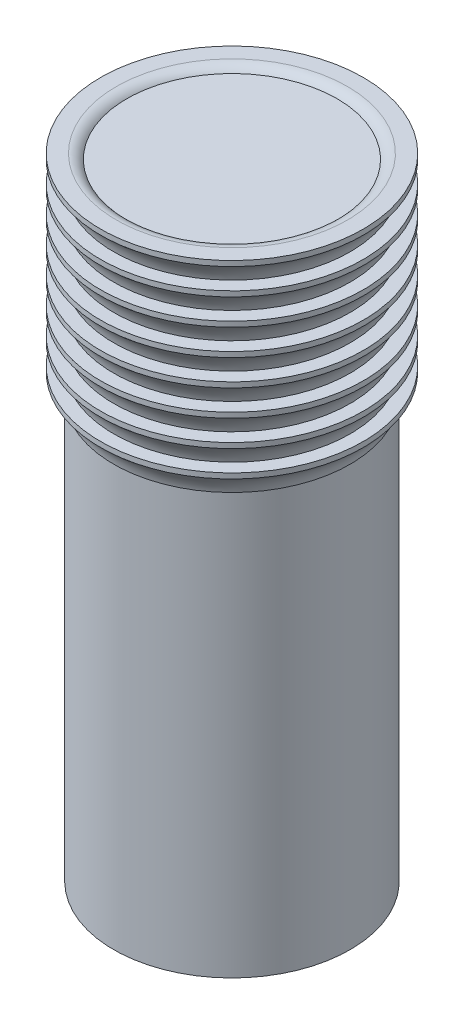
SolidWorks part; units mm, degrees
ref_plane "Alzado" through (0, 0, 0) normal (0, 0, 1) x (1, 0, 0)
ref_plane "Planta" through (0, 0, 0) normal (0, 1, 0) x (1, 0, 0)
ref_plane "Vista lateral" through (0, 0, 0) normal (1, 0, 0) x (0, 0, -1)
sketch "Croquis1" plane through (0, 0, 0) normal (0, 0, 1) x (1, 0, 0)
  line L0 (0, 0) -> (-25, 0)
  line L1 (-25, 0) -> (-25, -1)
  line L2 (-22.5, -5) -> (0, -5)
  line L3 (0, -5) -> (0, 0)
  line L5 (-25, 0) -> (-30.9208, 0)
  line L6 (-25, 0) -> (-25, -1)
  line L7 (-22.5, -5) -> (-30.1091, -5)
  arc A0 (-22.5, -5) -> (-25, -1) centre (-29.0964, -6.3415) ccw
  dimension "D4" = 22.5
  dimension "D1" = 25
  dimension "D2" = 5
  dimension "D3" = 1
revolve "Revolución2" add sketch "Croquis1" angle 360 about L3
pattern_linear "MatrizL1" count 8 spacing 5 along (0, 1, 0) of "Revolución2"
sketch "Croquis3" plane through (0, -5, 0) normal (0, -1, 0) x (1, 0, 0)
  circle A0 centre (0, 0) radius 22.5
  dimension "D1" = 45
extrude "Saliente-Extruir2" add sketch "Croquis3" along normal blind 80 separate body
sketch "Croquis4" plane through (0, 35, 0) normal (0, 1, 0) x (1, 0, 0)
  circle A0 centre (0, 0) radius 20
  dimension "D1" = 40
extrude "Cortar-Extruir1" cut sketch "Croquis4" against normal blind 1
fillet "Redondeo1" radius 2.5 1 edges at (0, 35, 20)
